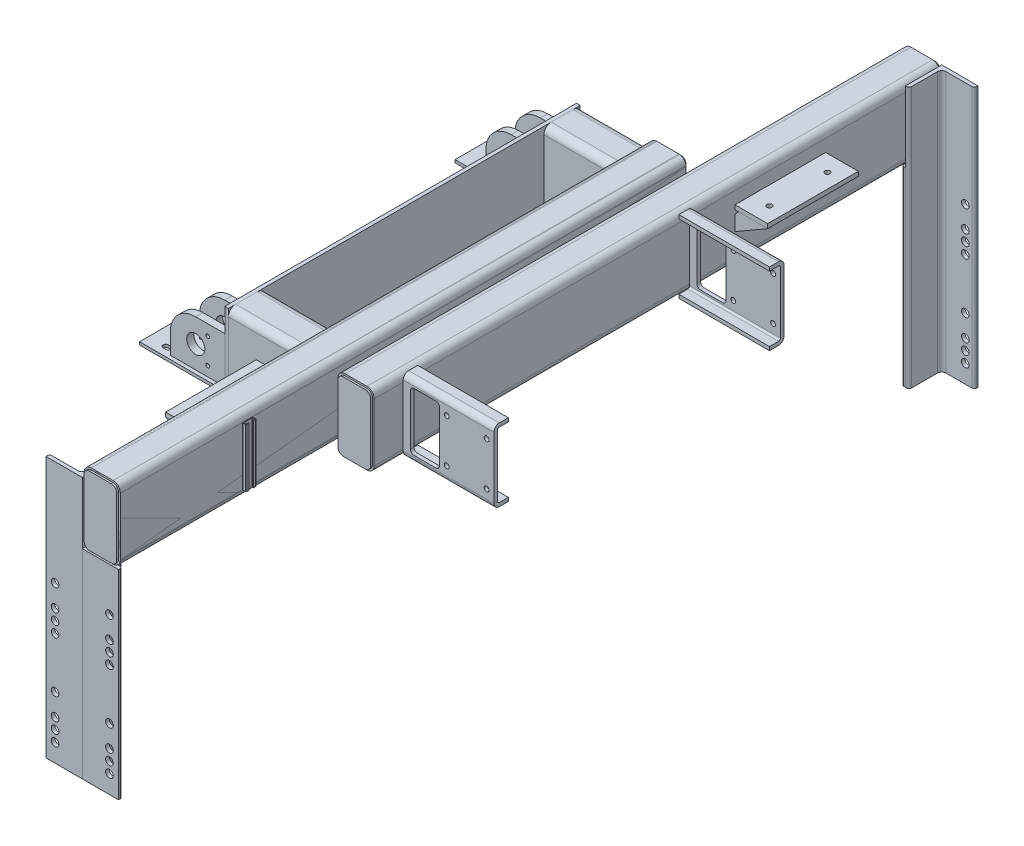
SolidWorks part; units mm, degrees
ref_plane "Plan de face" through (0, 0, 0) normal (0, 0, 1) x (1, 0, 0)
ref_plane "Plan de dessus" through (0, 0, 0) normal (0, 1, 0) x (1, 0, 0)
ref_plane "Plan de droite" through (0, 0, 0) normal (1, 0, 0) x (0, 0, -1)
sketch "Esquisse2" plane through (0, 0, 0) normal (0, 1, 0) x (1, 0, 0)
  line L0 (0, -1080) -> (0, 1080)
  dimension "D1" = 2160
  dimension "D2" = 1080
other "Elément mécano-soudé1"
ref_plane "Plan1" through (0, 0, 1080) normal (0, 0, -1) x (-1, 0, 0)
sketch "Esquisse1" plane through (0, -100, 1080) normal (0, 0, -1) x (-1, 0, 0)
  line L0 (-30, -90) -> (30, -90)
  line L1 (-40, -80) -> (-40, 80)
  line L2 (30, 90) -> (-30, 90)
  line L3 (40, 80) -> (40, -80)
  line L4 (-30, -100) -> (30, -100)
  line L5 (-50, -80) -> (-50, 80)
  line L6 (30, 100) -> (-30, 100)
  line L7 (50, 80) -> (50, -80)
  arc A0 (50, 80) -> (30, 100) centre (30, 80) ccw
  arc A1 (30, -100) -> (50, -80) centre (30, -80) ccw
  arc A2 (-50, -80) -> (-30, -100) centre (-30, -80) ccw
  arc A3 (-30, 100) -> (-50, 80) centre (-30, 80) ccw
  arc A4 (-30, 90) -> (-40, 80) centre (-30, 80) ccw
  arc A5 (40, 80) -> (30, 90) centre (30, 80) ccw
  arc A6 (30, -90) -> (40, -80) centre (30, -80) ccw
  arc A7 (-40, -80) -> (-30, -90) centre (-30, -80) ccw
  point P24 (0, 0)
  point P25 (40, 0)
  point P27 (50, 0)
  point P28 (0, -100)
  point P29 (0, -90)
  point P30 (-40, 0)
  point P31 (-50, 0)
  point P32 (0, 90)
  point P33 (0, 100)
  point P34 (30, 80)
  point P35 (50, 100)
  point P36 (50, -100)
  point P37 (30, -80)
  point P38 (-30, -80)
  point P39 (-50, -100)
  point P40 (-30, 80)
  point P41 (-50, 100)
  point P42 (0, 0)
  dimension "D1" = 20
  dimension "D2" = 10
  dimension "D3" = 100
  dimension "D4" = 200
  dimension "D5" = 50
  dimension "D6" = 100
mirror "Symétrie2" about plane through (0, 0, 0) normal (0, 0, 1)
ref_plane "Plan29" through (0, -25, 0) normal (0, 1, 0) x (-1, 0, 0)
sketch "Esquisse114" plane through (0, -25, 0) normal (0, 1, 0) x (1, 0, 0)
  line L0 (-50, -435) -> (-247, -435)
  line L1 (-50, 1080) -> (-50, -1080) construction
  dimension "D1" = 435
  dimension "D2" = 197
other "Elément mécano-soudé4"
ref_plane "Plan5" through (-50, -25, 435) normal (-1, 0, 0) x (0, 0, 1)
sketch "Esquisse117" plane through (-50, -125, 435) normal (-1, 0, 0) x (0, 0, 1)
  line L0 (-30, -90) -> (30, -90)
  line L1 (-40, -80) -> (-40, 80)
  line L2 (30, 90) -> (-30, 90)
  line L3 (40, 80) -> (40, -80)
  line L4 (-30, -100) -> (30, -100)
  line L5 (-50, -80) -> (-50, 80)
  line L6 (30, 100) -> (-30, 100)
  line L7 (50, 80) -> (50, -80)
  arc A0 (50, 80) -> (30, 100) centre (30, 80) ccw
  arc A1 (30, -100) -> (50, -80) centre (30, -80) ccw
  arc A2 (-50, -80) -> (-30, -100) centre (-30, -80) ccw
  arc A3 (-30, 100) -> (-50, 80) centre (-30, 80) ccw
  arc A4 (-30, 90) -> (-40, 80) centre (-30, 80) ccw
  arc A5 (40, 80) -> (30, 90) centre (30, 80) ccw
  arc A6 (30, -90) -> (40, -80) centre (30, -80) ccw
  arc A7 (-40, -80) -> (-30, -90) centre (-30, -80) ccw
  point P24 (0, 0)
  point P25 (40, 0)
  point P27 (50, 0)
  point P28 (0, -100)
  point P29 (0, -90)
  point P30 (-40, 0)
  point P31 (-50, 0)
  point P32 (0, 90)
  point P33 (0, 100)
  point P34 (30, 80)
  point P35 (50, 100)
  point P36 (50, -100)
  point P37 (30, -80)
  point P38 (-30, -80)
  point P39 (-50, -100)
  point P40 (-30, 80)
  point P41 (-50, 100)
  point P42 (0, 0)
  dimension "D1" = 20
  dimension "D2" = 10
  dimension "D3" = 100
  dimension "D4" = 200
  dimension "D5" = 50
  dimension "D6" = 100
mirror "Symétrie6" about plane through (0, 0, 0) normal (0, 0, 1)
sketch "Esquisse118" plane through (-247, 0, 0) normal (-1, 0, 0) x (0, 0, 1)
  line L1 (485, -25) -> (-485, -25)
  line L2 (485, -25) -> (485, -225)
  line L3 (485, -225) -> (-485, -225)
  line L4 (-485, -25) -> (-485, -225)
  line L5 (-485, -205) -> (-485, -45) construction
  line L8 (-405, -225) -> (-465, -225) construction
  line L9 (485, -205) -> (485, -45) construction
  dimension "D1" = 970
  dimension "D2" = 200
  dimension "D3" = 200
extrude "Extrusion1" add sketch "Esquisse118" along normal blind 10 separate body
ref_plane "Plan36" through (0, 0, 0) normal (0, 0, 1) x (1, 0, 0)
ref_plane "Plan9" through (0, 0, -1085) normal (0, 0, -1) x (-1, 0, 0)
sketch "Esquisse145" plane through (50, 0, 0) normal (1, 0, 0) x (0, 0, -1)
  line L0 (-1080, -20) -> (-1080, -180) construction
  line L1 (1524.936, 23.67) -> (480, 23.67)
  line L2 (1524.936, 23.67) -> (1524.936, -306.0157)
  line L3 (1524.936, -306.0157) -> (480, -306.0157)
  line L4 (480, 23.67) -> (480, -306.0157)
  dimension "D1" = 1560
extrude "Enlèv. mat.-Extru.1" cut sketch "Esquisse145" against normal up to surface (100 mm away)
sketch "Esquisse146" plane through (0, -25, 0) normal (0, 1, 0) x (1, 0, 0)
  line L0 (100, 1080) -> (100, -480)
  line L1 (-247, 485) -> (-50, 485) construction
  dimension "D1" = 100
  dimension "D2" = 595
  dimension "D3" = 1560
other "Elément mécano-soudé14"
ref_plane "Plan18" through (100, -25, -1080) normal (0, 0, 1) x (1, 0, 0)
sketch "Esquisse147" plane through (100, -125, -1080) normal (0, 0, 1) x (1, 0, 0)
  line L0 (-30, -90) -> (30, -90)
  line L1 (-40, -80) -> (-40, 80)
  line L2 (30, 90) -> (-30, 90)
  line L3 (40, 80) -> (40, -80)
  line L4 (-30, -100) -> (30, -100)
  line L5 (-50, -80) -> (-50, 80)
  line L6 (30, 100) -> (-30, 100)
  line L7 (50, 80) -> (50, -80)
  arc A0 (50, 80) -> (30, 100) centre (30, 80) ccw
  arc A1 (30, -100) -> (50, -80) centre (30, -80) ccw
  arc A2 (-50, -80) -> (-30, -100) centre (-30, -80) ccw
  arc A3 (-30, 100) -> (-50, 80) centre (-30, 80) ccw
  arc A4 (-30, 90) -> (-40, 80) centre (-30, 80) ccw
  arc A5 (40, 80) -> (30, 90) centre (30, 80) ccw
  arc A6 (30, -90) -> (40, -80) centre (30, -80) ccw
  arc A7 (-40, -80) -> (-30, -90) centre (-30, -80) ccw
  point P24 (0, 0)
  point P25 (40, 0)
  point P27 (50, 0)
  point P28 (0, -100)
  point P29 (0, -90)
  point P30 (-40, 0)
  point P31 (-50, 0)
  point P32 (0, 90)
  point P33 (0, 100)
  point P34 (30, 80)
  point P35 (50, 100)
  point P36 (50, -100)
  point P37 (30, -80)
  point P38 (-30, -80)
  point P39 (-50, -100)
  point P40 (-30, 80)
  point P41 (-50, 100)
  point P42 (0, 0)
  dimension "D1" = 20
  dimension "D2" = 10
  dimension "D3" = 100
  dimension "D4" = 200
  dimension "D5" = 50
  dimension "D6" = 100
sketch "Esquisse151" plane through (0, 0, 480) normal (0, 0, 1) x (1, 0, 0)
  line L0 (130, -25) -> (70, -25) construction
  line L1 (70, -30) -> (130, -30)
  line L2 (55, -45) -> (55, -205)
  line L3 (70, -220) -> (130, -220)
  line L4 (145, -45) -> (145, -205)
  line L5 (50, -45) -> (50, -205) construction
  line L7 (70, -225) -> (130, -225) construction
  line L8 (140, -205) -> (140, -45) construction
  arc A0 (130, -30) -> (145, -45) centre (130, -45) cw
  arc A1 (70, -30) -> (55, -45) centre (70, -45) ccw
  arc A2 (55, -205) -> (70, -220) centre (70, -205) ccw
  arc A3 (130, -220) -> (145, -205) centre (130, -205) ccw
  dimension "D5" = 15
  dimension "D1" = 5
  dimension "D2" = 5
  dimension "D3" = 5
  dimension "D4" = 5
extrude "Extrusion3" add sketch "Esquisse151" along normal blind 5 separate body
sketch "Esquisse152" plane through (0, 0, 1080) normal (0, 0, 1) x (1, 0, 0)
  line L0 (-30, 0) -> (30, 0) construction
  line L1 (-30, -5) -> (30, -5)
  line L2 (-45, -20) -> (-45, -180)
  line L3 (-30, -195) -> (30, -195)
  line L4 (45, -20) -> (45, -180)
  line L5 (50, -20) -> (50, -180) construction
  line L6 (30, -200) -> (-30, -200) construction
  line L7 (-50, -180) -> (-50, -20) construction
  arc A0 (30, -5) -> (45, -20) centre (30, -20) cw
  arc A1 (-30, -5) -> (-45, -20) centre (-30, -20) ccw
  arc A2 (-45, -180) -> (-30, -195) centre (-30, -180) ccw
  arc A3 (30, -195) -> (45, -180) centre (30, -180) ccw
  dimension "D5" = 15
  dimension "D1" = 5
  dimension "D2" = 5
  dimension "D3" = 5
  dimension "D4" = 5
extrude "Extrusion4" add sketch "Esquisse152" along normal blind 5 separate body
sketch "Esquisse153" plane through (0, 0, -480) normal (0, 0, -1) x (-1, 0, 0)
  line L0 (-30, 0) -> (30, 0) construction
  line L1 (-30, -5) -> (30, -5)
  line L2 (-45, -20) -> (-45, -180)
  line L3 (-30, -195) -> (30, -195)
  line L4 (45, -20) -> (45, -180)
  line L5 (-50, -45) -> (-50, -205) construction
  line L6 (50, -205) -> (50, -45) construction
  line L7 (30, -200) -> (-30, -200) construction
  arc A0 (-30, -5) -> (-45, -20) centre (-30, -20) ccw
  arc A1 (30, -5) -> (45, -20) centre (30, -20) cw
  arc A2 (30, -195) -> (45, -180) centre (30, -180) ccw
  arc A3 (-45, -180) -> (-30, -195) centre (-30, -180) ccw
  dimension "D5" = 15
  dimension "D1" = 5
  dimension "D2" = 5
  dimension "D3" = 5
  dimension "D4" = 5
extrude "Extrusion5" add sketch "Esquisse153" along normal blind 5 separate body
sketch "Esquisse154" plane through (0, 0, -1080) normal (0, 0, -1) x (-1, 0, 0)
  line L0 (-130, -25) -> (-70, -25) construction
  line L1 (-130, -30) -> (-70, -30)
  line L2 (-145, -45) -> (-145, -205)
  line L3 (-130, -220) -> (-70, -220)
  line L4 (-55, -45) -> (-55, -205)
  line L6 (-50, -45) -> (-50, -205) construction
  arc A0 (-130, -30) -> (-145, -45) centre (-130, -45) ccw
  arc A1 (-70, -30) -> (-55, -45) centre (-70, -45) cw
  arc A2 (-70, -220) -> (-55, -205) centre (-70, -205) ccw
  arc A3 (-145, -205) -> (-130, -220) centre (-130, -205) ccw
  dimension "D5" = 15
  dimension "D1" = 5
  dimension "D2" = 90
  dimension "D3" = 5
  dimension "D4" = 190
extrude "Extrusion6" add sketch "Esquisse154" along normal blind 5 separate body
sketch "Esquisse155" plane through (150, 0, 0) normal (1, 0, 0) x (0, 0, -1)
  line L0 (1085, -30) -> (1085, -750)
  line L2 (1080, -45) -> (1080, -25) construction
  line L3 (-480, -25) -> (1080, -25) construction
  dimension "D1" = 5
  dimension "D2" = 5
  dimension "D3" = 720
other "Elément mécano-soudé15"
ref_plane "Plan19" through (150, -30, -1085) normal (0, -1, 0) x (1, 0, 0)
sketch "Esquisse1501" plane through (150, -30, -1085) normal (0, -1, 0) x (1, 0, 0)
  line L0 (0, 100) -> (0, 0)
  line L1 (0, 100) -> (4, 100)
  line L2 (10, 94) -> (10, 22)
  line L3 (22, 10) -> (94, 10)
  line L4 (100, 0) -> (100, 4)
  line L5 (100, 0) -> (0, 0)
  arc A0 (22, 10) -> (10, 22) centre (22, 22) cw
  arc A1 (4, 100) -> (10, 94) centre (4, 94) cw
  arc A2 (100, 4) -> (94, 10) centre (94, 4) ccw
  point P2 (50, 0)
  point P4 (0, 50)
  point P6 (0, 0)
  point P16 (10, 58)
  point P17 (58, 10)
  point P18 (10, 10)
  point P19 (100, 10)
  point P20 (10, 100)
  point P21 (0, 0)
  dimension "D1" = 12
  dimension "D2" = 10
  dimension "D3" = 10
  dimension "D6" = 6
  dimension "D5" = 100
  dimension "D4" = 100
sketch "Esquisse1502" plane through (0, 0, -1085) normal (0, 0, -1) x (-1, 0, 0)
  line L0 (-50, -225) -> (-50, -750)
  line L3 (-150, -750) -> (-250, -750) construction
  line L4 (-150, -30) -> (-150, -750) construction
  line L7 (-70, -225) -> (-130, -225) construction
  dimension "D1" = 100
other "Elément mécano-soudé16"
ref_plane "Plan20" through (50, -225, -1085) normal (0, -1, 0) x (1, 0, 0)
sketch "Esquisse156" plane through (150, -225, -1085) normal (0, -1, 0) x (0, 0, 1)
  line L0 (0, 100) -> (0, 0)
  line L1 (0, 100) -> (4, 100)
  line L2 (10, 94) -> (10, 22)
  line L3 (22, 10) -> (94, 10)
  line L4 (100, 0) -> (100, 4)
  line L5 (100, 0) -> (0, 0)
  arc A0 (22, 10) -> (10, 22) centre (22, 22) cw
  arc A1 (4, 100) -> (10, 94) centre (4, 94) cw
  arc A2 (100, 4) -> (94, 10) centre (94, 4) ccw
  point P2 (50, 0)
  point P4 (0, 50)
  point P6 (0, 0)
  point P16 (10, 58)
  point P17 (58, 10)
  point P18 (10, 10)
  point P19 (100, 10)
  point P20 (10, 100)
  point P21 (0, 0)
  dimension "D1" = 12
  dimension "D2" = 10
  dimension "D3" = 10
  dimension "D6" = 6
  dimension "D5" = 100
  dimension "D4" = 100
sketch "Esquisse1503" plane through (-50, 0, 0) normal (-1, 0, 0) x (0, 0, 1)
  line L0 (1085, -30) -> (1085, -750)
  line L2 (1080, -20) -> (1080, -180) construction
  line L4 (-480, 0) -> (1080, 0) construction
  dimension "D1" = 30
  dimension "D2" = 5
  dimension "D3" = 720
other "Elément mécano-soudé17"
ref_plane "Plan21" through (-50, -30, 1085) normal (0, -1, 0) x (1, 0, 0)
sketch "Esquisse157" plane through (-50, -30, 1085) normal (0, -1, 0) x (-1, 0, 0)
  line L0 (0, 100) -> (0, 0)
  line L1 (0, 100) -> (4, 100)
  line L2 (10, 94) -> (10, 22)
  line L3 (22, 10) -> (94, 10)
  line L4 (100, 0) -> (100, 4)
  line L5 (100, 0) -> (0, 0)
  arc A0 (22, 10) -> (10, 22) centre (22, 22) cw
  arc A1 (4, 100) -> (10, 94) centre (4, 94) cw
  arc A2 (100, 4) -> (94, 10) centre (94, 4) ccw
  point P2 (50, 0)
  point P4 (0, 50)
  point P6 (0, 0)
  point P16 (10, 58)
  point P17 (58, 10)
  point P18 (10, 10)
  point P19 (100, 10)
  point P20 (10, 100)
  point P21 (0, 0)
  dimension "D1" = 12
  dimension "D2" = 10
  dimension "D3" = 10
  dimension "D6" = 6
  dimension "D5" = 100
  dimension "D4" = 100
sketch "Esquisse1504" plane through (0, 0, 1085) normal (0, 0, 1) x (1, 0, 0)
  line L0 (50, -200) -> (50, -750)
  dimension "D1" = 550
other "Elément mécano-soudé18"
ref_plane "Plan22" through (50, -200, 1085) normal (0, -1, 0) x (1, 0, 0)
sketch "Esquisse158" plane through (-50, -200, 1085) normal (0, -1, 0) x (0, 0, -1)
  line L0 (0, 100) -> (0, 0)
  line L1 (0, 100) -> (4, 100)
  line L2 (10, 94) -> (10, 22)
  line L3 (22, 10) -> (94, 10)
  line L4 (100, 0) -> (100, 4)
  line L5 (100, 0) -> (0, 0)
  arc A0 (22, 10) -> (10, 22) centre (22, 22) cw
  arc A1 (4, 100) -> (10, 94) centre (4, 94) cw
  arc A2 (100, 4) -> (94, 10) centre (94, 4) ccw
  point P2 (50, 0)
  point P4 (0, 50)
  point P6 (0, 0)
  point P16 (10, 58)
  point P17 (58, 10)
  point P18 (10, 10)
  point P19 (100, 10)
  point P20 (10, 100)
  point P21 (0, 0)
  dimension "D1" = 12
  dimension "D2" = 10
  dimension "D3" = 10
  dimension "D6" = 6
  dimension "D5" = 100
  dimension "D4" = 100
sketch "Esquisse1505" plane through (0, 0, 1085) normal (0, 0, 1) x (1, 0, 0)
  line L0 (-150, -750) -> (-150, -30) construction
  line L2 (-50, -750) -> (-150, -750) construction
  circle A0 centre (-125, -700) radius 10.5
  circle A1 centre (-125, -670) radius 10.5
  circle A2 centre (-125, -640) radius 10.5
  circle A3 centre (-125, -440) radius 10.5
  circle A4 centre (-125, -410) radius 10.5
  circle A5 centre (-125, -380) radius 10.5
  circle A6 centre (-125, -580) radius 10.5
  circle A7 centre (-125, -320) radius 10.5
  point P16 (-100, -750)
  dimension "D1" = 50
  dimension "D9" = 60
  dimension "D3" = 21
  dimension "D10" = 60
  dimension "D2" = 25
  dimension "D4" = 30
  dimension "D5" = 30
  dimension "D6" = 200
  dimension "D7" = 30
  dimension "D8" = 30
extrude "Enlèv. mat.-Extru.2" cut sketch "Esquisse1505" against normal blind 20
sketch "Esquisse1506" plane through (0, 0, 1085) normal (0, 0, 1) x (1, 0, 0)
  line L1 (50, -750) -> (-50, -750) construction
  circle A0 centre (25, -700) radius 10.5
  circle A1 centre (25, -670) radius 10.5
  circle A2 centre (25, -640) radius 10.5
  circle A3 centre (25, -440) radius 10.5
  circle A4 centre (25, -410) radius 10.5
  circle A5 centre (25, -380) radius 10.5
  circle A7 centre (25, -580) radius 10.5
  circle A8 centre (25, -320) radius 10.5
  circle A9 centre (-125, -700) radius 10.5 construction
  dimension "D1" = 21
  dimension "D2" = 30
  dimension "D9" = 60
  dimension "D10" = 60
  dimension "D8" = 150
  dimension "D3" = 30
  dimension "D4" = 30
  dimension "D5" = 30
  dimension "D6" = 50
  dimension "D7" = 200
extrude "Enlèv. mat.-Extru.3" cut sketch "Esquisse1506" against normal blind 10
sketch "Esquisse1507" plane through (0, 0, -1085) normal (0, 0, -1) x (-1, 0, 0)
  line L0 (-250, -750) -> (-250, -30) construction
  line L1 (-150, -750) -> (-250, -750) construction
  circle A0 centre (-225, -700) radius 10.5
  circle A1 centre (-225, -670) radius 10.5
  circle A2 centre (-225, -640) radius 10.5
  circle A3 centre (-225, -440) radius 10.5
  circle A4 centre (-225, -410) radius 10.5
  circle A5 centre (-225, -380) radius 10.5
  circle A6 centre (-225, -580) radius 10.5
  circle A7 centre (-225, -320) radius 10.5
  point P14 (-200, -750)
  dimension "D1" = 21
  dimension "D9" = 60
  dimension "D10" = 60
  dimension "D2" = 30
  dimension "D3" = 30
  dimension "D4" = 30
  dimension "D5" = 30
  dimension "D6" = 200
  dimension "D7" = 50
  dimension "D8" = 25
extrude "Enlèv. mat.-Extru.4" cut sketch "Esquisse1507" against normal blind 10
sketch "Esquisse1508" plane through (0, 0, -1085) normal (0, 0, -1) x (-1, 0, 0)
  line L1 (-50, -750) -> (-150, -750) construction
  circle A0 centre (-75, -380) radius 10.5
  circle A1 centre (-75, -410) radius 10.5
  circle A2 centre (-75, -440) radius 10.5
  circle A3 centre (-75, -640) radius 10.5
  circle A4 centre (-75, -670) radius 10.5
  circle A5 centre (-75, -700) radius 10.5
  circle A7 centre (-225, -700) radius 10.5 construction
  circle A8 centre (-75, -320) radius 10.5
  circle A9 centre (-75, -580) radius 10.5
  dimension "D1" = 21
  dimension "D8" = 150
  dimension "D9" = 60
  dimension "D10" = 60
  dimension "D2" = 30
  dimension "D3" = 30
  dimension "D4" = 200
  dimension "D5" = 30
  dimension "D6" = 30
  dimension "D7" = 50
extrude "Enlèv. mat.-Extru.5" cut sketch "Esquisse1508" against normal blind 10
sheet metal parameters "Tôlerie 1" thickness 5 parameters "D1"=0.7366, "Epaisseur"=5
sketch "Esquisse1518" plane through (150, 0, 0) normal (1, 0, 0) x (0, 0, -1)
  line L0 (515, -79) -> (765, -79)
  line L2 (-1080, 0) -> (1080, 0) construction
  line L3 (1080, -45) -> (1080, -25) construction
  dimension "D1" = 250
  dimension "D2" = 315
  dimension "D3" = 79
other "Elément mécano-soudé20"
ref_plane "Plan24" through (150, -79, -515) normal (0, 0, -1) x (-1, 0, 0)
sketch "Esquisse1512" plane through (195, -91, -515) normal (0, 0, -1) x (-1, 0, 0)
  line L1 (-45, 12) -> (45, 12)
  line L2 (-45, 12) -> (-45, 0)
  line L3 (-45, 0) -> (45, 0)
  line L4 (45, 12) -> (45, 0)
  point P4 (0, 0)
  point P6 (0, 0)
  dimension "D1" = 90
  dimension "D2" = 12
sketch "Esquisse1519" plane through (0, -79, 0) normal (0, 1, 0) x (1, 0, 0)
  line L0 (240, 765) -> (240, 515) construction
  line L1 (150, 765) -> (240, 765) construction
  circle A0 centre (200, 720) radius 7
  circle A1 centre (200, 560) radius 7
  dimension "D1" = 14
  dimension "D2" = 40
  dimension "D3" = 40
  dimension "D4" = 160
  dimension "D5" = 45
extrude "Enlèv. mat.-Extru.7" cut sketch "Esquisse1519" against normal blind 20
sketch "Esquisse1520" plane through (0, 0, -765) normal (0, 0, -1) x (-1, 0, 0)
  line L0 (-240, -91) -> (-150, -142.9615)
  line L1 (-150, -30) -> (-150, -750) construction
  line L2 (-240, -91) -> (-150, -91) construction
  line L3 (-240, -91) -> (-150, -91)
  line L4 (-150, -91) -> (-150, -142.9615)
  dimension "D1" = 30
  dimension "D2" = 90
extrude "Extrusion7" add sketch "Esquisse1520" against normal blind 10 separate body
chamfer "Chanfrein1" distance 10 angle 45 1 edges at (150, -91, -760)
ref_plane "Plan25" through (0, 0, -640) normal (0, 0, -1) x (-1, 0, 0)
mirror "Symétrie10" about plane through (0, 0, -640) normal (0, 0, -1)
sketch "Esquisse1522" plane through (-50, 0, 0) normal (-1, 0, 0) x (0, 0, 1)
  line L0 (765, -79) -> (515, -79)
  line L1 (485, -225) -> (485, -25) construction
  line L2 (1080, 0) -> (-1080, 0) construction
  dimension "D1" = 250
  dimension "D2" = 30
  dimension "D3" = 79
other "Elément mécano-soudé21"
ref_plane "Plan26" through (-50, -79, 765) normal (0, 0, -1) x (-1, 0, 0)
sketch "Esquisse1513" plane through (-95, -91, 765) normal (0, 0, -1) x (-1, 0, 0)
  line L1 (-45, 12) -> (45, 12)
  line L2 (-45, 12) -> (-45, 0)
  line L3 (-45, 0) -> (45, 0)
  line L4 (45, 12) -> (45, 0)
  point P4 (0, 0)
  point P6 (0, 0)
  dimension "D1" = 90
  dimension "D2" = 12
sketch "Esquisse1523" plane through (0, -79, 0) normal (0, 1, 0) x (1, 0, 0)
  line L0 (-140, -515) -> (-50, -515) construction
  line L1 (-140, -515) -> (-140, -765) construction
  circle A0 centre (-100, -560) radius 7
  circle A1 centre (-100, -720) radius 7
  dimension "D1" = 14
  dimension "D2" = 160
  dimension "D3" = 45
  dimension "D4" = 40
extrude "Enlèv. mat.-Extru.8" cut sketch "Esquisse1523" against normal blind 20
sketch "Esquisse1524" plane through (0, 0, 765) normal (0, 0, 1) x (1, 0, 0)
  line L0 (-140, -91) -> (-50, -91)
  line L1 (-50, -91) -> (-50, -142.9615)
  line L2 (-50, -142.9615) -> (-140, -91)
  dimension "D1" = 30
extrude "Extrusion8" add sketch "Esquisse1524" against normal blind 10 separate body
chamfer "Chanfrein2" distance 10 angle 45 1 edges at (-50, -91, 760)
ref_plane "Plan27" through (0, 0, 640) normal (0, 0, 1) x (1, 0, 0)
mirror "Symétrie11" about plane through (0, 0, 640) normal (0, 0, 1)
sketch "Esquisse1525" plane through (150, 0, 0) normal (1, 0, 0) x (0, 0, -1)
  line L0 (0, 426.9064) -> (0, -734.9244) construction
  line L1 (-400, -25) -> (-400, -225)
  line L2 (-400, -25) -> (-360, -25)
  line L3 (-400, -225) -> (-360, -225)
  line L5 (-480, -225) -> (1080, -225) construction
  line L6 (-480, -25) -> (1080, -25) construction
  dimension "D1" = 400
  dimension "D3" = 40
  dimension "D4" = 40
extrude "Extru.-Mince1" add sketch "Esquisse1525" along normal blind 250 separate body thin
sketch "Esquisse1527" plane through (0, 0, 400) normal (0, 0, 1) x (1, 0, 0)
  line L0 (270, -65) -> (447.0276, -65) construction
  line L1 (380, -185) -> (221.2161, -185) construction
  line L2 (270, -65) -> (270, -179.5053) construction
  line L3 (400, -25) -> (150, -25) construction
  line L4 (400, -40) -> (400, -210) construction
  circle A0 centre (380, -65) radius 6.75
  circle A1 centre (270, -65) radius 6.75
  circle A2 centre (380, -185) radius 6.75
  circle A3 centre (270, -185) radius 6.75
  point P13 (400, -125)
  dimension "D1" = 13.5
  dimension "D2" = 110
  dimension "D3" = 110
  dimension "D4" = 120
  dimension "D5" = 120
  dimension "D6" = 40
  dimension "D7" = 20
extrude "Enlèv. mat.-Extru.9" cut sketch "Esquisse1527" against normal blind 20
sketch "Esquisse1528" plane through (0, 0, 400) normal (0, 0, 1) x (1, 0, 0)
  line L0 (400, -25) -> (150, -25) construction
  line L1 (180, -45) -> (240, -45)
  line L2 (170, -55) -> (170, -195)
  line L3 (180, -205) -> (240, -205)
  line L4 (250, -55) -> (250, -195)
  line L5 (400, -225) -> (150, -225) construction
  line L6 (150, -30) -> (150, -750) construction
  arc A0 (180, -45) -> (170, -55) centre (180, -55) ccw
  arc A1 (240, -45) -> (250, -55) centre (240, -55) cw
  arc A2 (240, -205) -> (250, -195) centre (240, -195) ccw
  arc A3 (170, -195) -> (180, -205) centre (180, -195) ccw
  dimension "D5" = 10
  dimension "D1" = 20
  dimension "D2" = 20
  dimension "D3" = 20
  dimension "D4" = 80
extrude "Enlèv. mat.-Extru.10" cut sketch "Esquisse1528" against normal blind 10
mirror "Symétrie12" about plane through (0, 0, 0) normal (0, 0, 1)
ref_plane "Plan32" through (-30, -200, 1080) normal (0, 0, -1) x (-1, 0, 0)
inserted part "OC0154"
move or copy body "Corps-Déplacer/Copier10" placed by mates yes
other "Distance10" parameters "D1"=405
other "Distance13" parameters "D1"=8
other "<OC0154>-<Extrusion1>"
inserted part "OC0155"
move or copy body "Corps-Déplacer/Copier12" placed by mates yes
other "Distance11" parameters "D1"=60
other "<OC0155>-<Trou taraudé M121>"
mirror "Symétrie13" about plane through (0, 0, 0) normal (0, 0, 1)
inserted part "OC0013"
move or copy body "Corps-Déplacer/Copier14" placed by mates yes
other "Distance16" parameters "D1"=10
other "<OC0013>-<Tôle de base pliée1>"
mirror "Symétrie14" about plane through (0, 0, 0) normal (0, 0, 1)
sketch "Esquisse1529" plane through (50, 0, 0) normal (1, 0, 0) x (0, 0, -1)
  line L0 (-730, -20) -> (-730, -180)
  line L4 (-1080, -180) -> (480, -180) construction
  line L5 (-1080, -20) -> (480, -20) construction
  line L6 (-1080, -20) -> (-1080, -180) construction
  dimension "D1" = 350
other "Elément mécano-soudé22"
ref_plane "Plan37" through (50, -20, 730) normal (0, -1, 0) x (0, 0, 1)
sketch "Esquisse21" plane through (50, -20, 730) normal (0, -1, 0) x (0, 0, -1)
  line L0 (-11.5, 0) -> (11.5, 0)
  line L1 (-14, 2.5) -> (-14, 8.5)
  line L2 (14, 2.5) -> (14, 8.5)
  line L3 (-11.5, 11) -> (-6, 11)
  line L4 (11.5, 11) -> (6, 11)
  line L5 (11.5, 9) -> (6, 9)
  line L6 (12, 2.5) -> (12, 8.5)
  line L7 (-11.5, 2) -> (11.5, 2)
  line L8 (-12, 2.5) -> (-12, 8.5)
  line L9 (-11.5, 9) -> (-6, 9)
  line L10 (-6, 9) -> (-6, 11)
  line L11 (6, 9) -> (6, 11)
  arc A0 (-11.5, 0) -> (-14, 2.5) centre (-11.5, 2.5) cw
  arc A1 (-14, 8.5) -> (-11.5, 11) centre (-11.5, 8.5) cw
  arc A2 (14, 8.5) -> (11.5, 11) centre (11.5, 8.5) ccw
  arc A3 (11.5, 0) -> (14, 2.5) centre (11.5, 2.5) ccw
  arc A4 (12, 8.5) -> (11.5, 9) centre (11.5, 8.5) ccw
  arc A5 (11.5, 2) -> (12, 2.5) centre (11.5, 2.5) ccw
  arc A6 (-11.5, 2) -> (-12, 2.5) centre (-11.5, 2.5) cw
  arc A7 (-12, 8.5) -> (-11.5, 9) centre (-11.5, 8.5) cw
  point P3 (0, 0)
  point P10 (-14, 0)
  point P13 (-14, 11)
  point P18 (14, 0)
  point P33 (0, 11)
  point P34 (14, 11)
  point P35 (0, 0)
  dimension "D4" = 2.5
  dimension "D5" = 2.5
  dimension "D1" = 28
  dimension "D2" = 11
  dimension "D3" = 8
  dimension "D6" = 2
